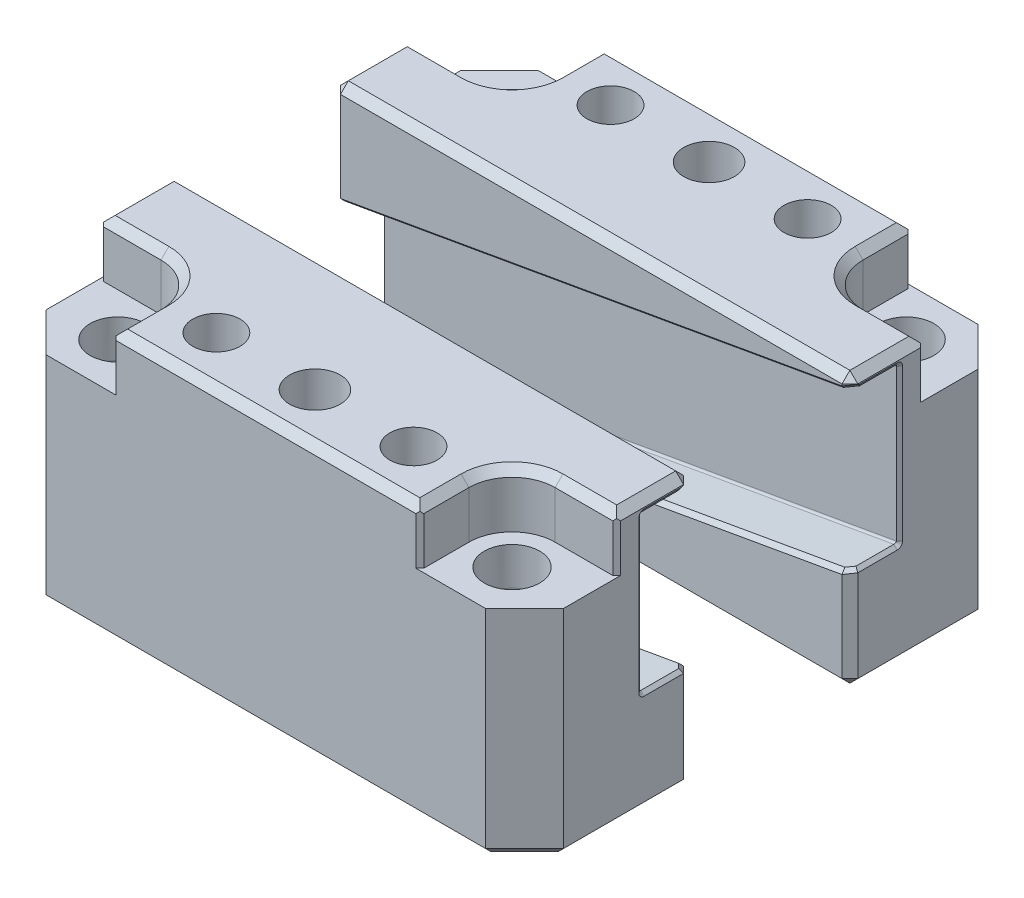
SolidWorks part; units mm, degrees
ref_plane "Front Plane" through (0, 0, 0) normal (0, 0, 1) x (1, 0, 0)
ref_plane "Top Plane" through (0, 0, 0) normal (0, 1, 0) x (1, 0, 0)
ref_plane "Right Plane" through (0, 0, 0) normal (1, 0, 0) x (0, 0, -1)
sketch "Sketch1" plane through (0, 0, 0) normal (1, 0, 0) x (0, 0, -1)
  line L0 (-10.2108, 0) -> (-10.2108, 34.925)
  line L1 (-10.2108, 34.925) -> (-31.7246, 34.925)
  line L2 (-31.7246, 34.925) -> (-31.7246, 0)
  line L3 (-31.7246, 0) -> (-10.2108, 0)
  line L4 (0, 48.255) -> (0, -16.2311) construction
  dimension "D1" = 20.4216
  dimension "D2" = 34.925
  dimension "D3" = 63.4492
  dimension "D4" = 21.5138
extrude "Boss-Extrude1" add sketch "Sketch1" along normal mid plane 66.675
hole_wizard "CBORE for 1/4 Socket Head Cap Screw1" positions "Sketch4" profile "Sketch3" counterbore size "1/4" standard "ANSI Inch"
sketch "Sketch4" plane through (0, 34.925, 0) normal (0, 1, 0) x (1, 0, 0)
  line L0 (0, 7.4267) -> (0, -36.2312) construction
  line L2 (-19.6518, 0) -> (14.0148, 0) construction
  point P0 (-25.4, -25.4)
  point P11 (25.4, -25.4)
  dimension "D1" = 50.8
  dimension "D2" = 50.8
sketch "Sketch3" plane through (-25.4, 34.925, 25.4) normal (1, 0, 0) x (0, 0, 1)
  line L0 (0, 0) -> (0, 34.925)
  line L1 (0, 34.925) -> (3.5712, 34.925)
  line L3 (3.5712, 34.925) -> (3.5712, 7.112)
  line L4 (3.5712, 7.112) -> (5.5562, 7.112)
  line L5 (5.5562, 7.112) -> (5.5562, 0)
  line L7 (5.5562, 0) -> (0, 0)
  line L11 (0, -6.35) -> (0, 107.95) construction
  dimension "Thru Hole Dia." = 7.1425
  dimension "Thru Hole Depth" = 34.925
  dimension "C'Bore Dia." = 11.1125
  dimension "C'Bore Depth" = 7.112
hole_wizard "5/16-18 Tapped Hole1" positions "Sketch6" profile "Sketch5" tap size "5/16-18" standard "ANSI Inch"
sketch "Sketch6" plane through (0, 34.925, 0) normal (0, 1, 0) x (1, 0, 0)
  line L0 (0, 2.7703) -> (0, -32.9614) construction
  line L2 (-8.3627, 0) -> (4.6629, 0) construction
  line L4 (25.4, -25.4) -> (-25.4, -25.4) construction
  point P2 (0, -25.4)
sketch "Sketch5" plane through (0, 34.925, 25.4) normal (1, 0, 0) x (0, 0, 1)
  line L0 (0, 0) -> (0, 24.8973)
  line L1 (0, 24.8973) -> (3.2639, 22.9362)
  line L2 (3.2639, 22.9362) -> (3.2639, 0)
  line L5 (3.2639, 0) -> (0, 0)
  line L10 (0, 24.8973) -> (-3.2639, 22.9362) construction
  line L11 (0, -6.35) -> (0, 107.95) construction
  dimension "Tap Drill Dia." = 6.5278
  dimension "Tap Drill Depth" = 22.9362
  dimension "Drill Angle" = 118
chamfer "Chamfer1" distance 5 angle 45 2 edges at (33.3375, 17.4625, 31.7246) (-33.3375, 17.4625, 31.7246)
ref_plane "Plane3" through (0, 0, 25.4) normal (0, 0, 1) x (1, 0, 0)
sketch "Sketch17" plane through (0, 0, 25.4) normal (0, 0, 1) x (1, 0, 0)
  line L0 (-15.748, 34.925) -> (-15.748, 12.7763)
  line L1 (-15.748, 12.7763) -> (-15.875, 12.7)
  line L2 (-15.875, 12.7) -> (-15.875, 0)
  line L3 (-15.875, 0) -> (-12.7, 0)
  line L4 (-12.7, 0) -> (-12.7, 34.925)
  line L5 (-12.7, 34.925) -> (-15.748, 34.925)
  line L6 (-12.7, 38.1219) -> (-12.7, -4.206) construction
  line L7 (28.3375, 0) -> (-28.3375, 0) construction
  line L8 (0, 0) -> (0, 41.1299) construction
  line L9 (28.3375, 34.925) -> (-28.3375, 34.925) construction
  dimension "D1" = 12.7
  dimension "D2" = 59
  dimension "D3" = 6.35
  dimension "D4" = 6.096
  dimension "D5" = 25.4
revolve "Cut-Revolve2" cut sketch "Sketch17" angle 360 about L6
mirror "Mirror1" about plane through (0, 0, 0) normal (1, 0, 0) of "Cut-Revolve2"
sketch "Sketch8" plane through (0, 34.925, 0) normal (0, 1, 0) x (1, 0, 0)
  line L0 (-25.4, -19.8438) -> (-33.3375, -19.8438)
  line L2 (-33.3375, -10.2108) -> (-33.3375, -26.7246) construction
  line L3 (-33.3375, -19.8438) -> (-33.3375, -31.7246)
  line L4 (-33.3375, -31.7246) -> (-19.8437, -31.7246)
  line L5 (28.3375, -31.7246) -> (-28.3375, -31.7246) construction
  line L6 (-19.8437, -31.7246) -> (-19.8437, -25.4)
  line L7 (0, -4.7359) -> (0, -39.2525) construction
  line L8 (19.8438, -31.7246) -> (19.8437, -25.4)
  line L9 (33.3375, -31.7246) -> (19.8438, -31.7246)
  line L10 (33.3375, -19.8438) -> (33.3375, -31.7246)
  line L11 (25.4, -19.8438) -> (33.3375, -19.8438)
  circle A0 centre (-25.4, -25.4) radius 5.5562 construction
  circle A1 centre (-25.4, -25.4) radius 5.5562 construction
  arc A2 (-19.8437, -25.4) -> (-25.4, -19.8438) centre (-25.4, -25.4) ccw
  arc A3 (19.8437, -25.4) -> (25.4, -19.8438) centre (25.4, -25.4) cw
extrude "Cut-Extrude3" cut sketch "Sketch8" against normal up to surface (7.112 mm away)
sketch "Sketch9" plane through (0, 0, 10.2108) normal (0, 0, -1) x (-1, 0, 0)
  line L0 (0, 34.925) -> (0, 0) construction
  line L1 (-33.3375, 34.925) -> (33.3375, 34.925) construction
  line L2 (33.3375, 0) -> (33.3375, 34.925) construction
  line L3 (-33.3375, 33.3484) -> (33.3375, 21.5918)
  line L4 (-33.3375, 33.3484) -> (-33.3375, 13.3332)
  line L5 (-33.3375, 13.3332) -> (33.3375, 1.5766)
  line L6 (33.3375, 21.5918) -> (33.3375, 1.5766)
  line L7 (-33.3375, 33.3484) -> (33.3375, 1.5766) construction
  line L8 (-33.3375, 13.3332) -> (33.3375, 21.5918) construction
  line L9 (-17.9033, 17.4625) -> (0, 17.4625) construction
  line L10 (-33.3375, 23.3408) -> (33.3375, 11.5842) construction
  line L11 (-33.3375, 0) -> (-33.3375, 34.925) construction
  point P5 (0, 17.4625)
  dimension "D1" = 20.0152
  dimension "D2" = 10
extrude "Cut-Extrude4" cut sketch "Sketch9" against normal offset from surface (6.35 mm away) 16.5608
hole_wizard "5/16-18 Tapped Hole2" positions "Sketch11" profile "Sketch10" tap size "5/16-18" standard "ANSI Inch"
sketch "Sketch11" plane through (0, 0, 0) normal (0, -1, 0) x (-1, 0, 0)
  point P0 (25.4, -25.4)
  point P3 (-25.4, -25.4)
sketch "Sketch10" plane through (-25.4, 0, 25.4) normal (1, 0, 0) x (0, 0, -1)
  line L0 (0, 0) -> (0, 25.0881)
  line L1 (0, 25.0881) -> (3.5814, 22.9362)
  line L2 (3.5814, 22.9362) -> (3.5814, 0)
  line L5 (3.5814, 0) -> (0, 0)
  line L10 (0, 25.0881) -> (-3.5814, 22.9362) construction
  line L11 (0, -6.35) -> (0, 107.95) construction
  dimension "Tap Drill Dia." = 7.1628
  dimension "Tap Drill Depth" = 22.9362
  dimension "Drill Angle" = 118
ref_plane "Plane1" through (-2.9863, 16.9359, 0) normal (-0.1736, 0.9848, 0) x (0.9848, 0.1736, 0)
fillet "Fillet1" radius 0.254 2 edges at (0, 7.4549, 16.5608) (0, 27.4701, 16.5608)
chamfer "Chamfer2" distance 1.016 angle 45 20 edges at (0, 0, 10.2108) (33.3375, 6.6666, 10.2108) (33.3375, 0, 18.4677) (30.8375, 0, 29.2246) (0, 0, 31.7246) (-30.8375, 0, 29.2246) (-33.3375, 0, 18.4677) (-33.3375, 0.7883, 10.2108) (-21.4711, 34.925, 21.4711) (-33.3375, 34.925, 15.0273) (-33.3375, 28.2584, 10.2108) (0, 34.925, 10.2108) (0, 34.925, 31.7246) (21.4711, 34.925, 21.4711) (33.3375, 34.925, 15.0273) (33.3375, 34.1367, 10.2108) (-19.8437, 34.925, 28.5623) (-29.3687, 34.925, 19.8438) (19.8438, 34.925, 28.5623) (29.3687, 34.925, 19.8438)
chamfer "Chamfer3" distance 0.508 angle 45 20 edges at (33.3375, 33.3484, 13.7668) (33.3375, 33.2729, 16.4864) (33.3375, 23.3408, 16.5608) (33.3375, 13.4087, 16.4864) (33.3375, 13.3332, 13.7668) (0, 7.4549, 10.2108) (0, 27.4701, 10.2108) (-33.3375, 1.5766, 13.7668) (-33.3375, 1.6521, 16.4864) (-33.3375, 11.5842, 16.5608) (-33.3375, 21.5163, 16.4864) (-33.3375, 21.5918, 13.7668) (-32.8295, 1.6662, 10.7188) (-32.8295, 21.6814, 10.7188) (32.8295, 13.2436, 10.7188) (32.8295, 33.2588, 10.7188) (33.3375, 30.861, 19.8438) (19.8438, 30.861, 31.7246) (-19.8437, 30.861, 31.7246) (-33.3375, 30.861, 19.8438)
ref_plane "Plane2" through (19.05, 0, 0) normal (1, 0, 0) x (0, 0, -1)
sketch "Sketch18" plane through (19.05, 0, 0) normal (1, 0, 0) x (0, 0, -1)
  line L0 (-15.875, 0) -> (-15.875, 6.8643) construction
  line L1 (-15.875, 4.93) -> (-14.375, 4.064)
  line L2 (-14.375, 4.064) -> (-14.375, 0)
  line L3 (-14.375, 0) -> (-15.875, 0)
  line L4 (-15.875, 0) -> (-15.875, 4.93)
  line L5 (-25.4, 12.6149) -> (-25.4, -12.6149) construction
  line L6 (-11.2268, 0) -> (-26.3038, 0) construction
  dimension "D1" = 60
  dimension "D2" = 4.064
  dimension "D3" = 3
  dimension "D4" = 9.525
revolve "Cut-Revolve3" cut sketch "Sketch18" angle 360 about L0
chamfer "Chamfer4" distance 0.508 angle 45 2 edges at (-15.875, 0, 25.4) (15.875, 0, 25.4)
mirror "Mirror2" about plane through (0, 0, 0) normal (0, 0, 1)
